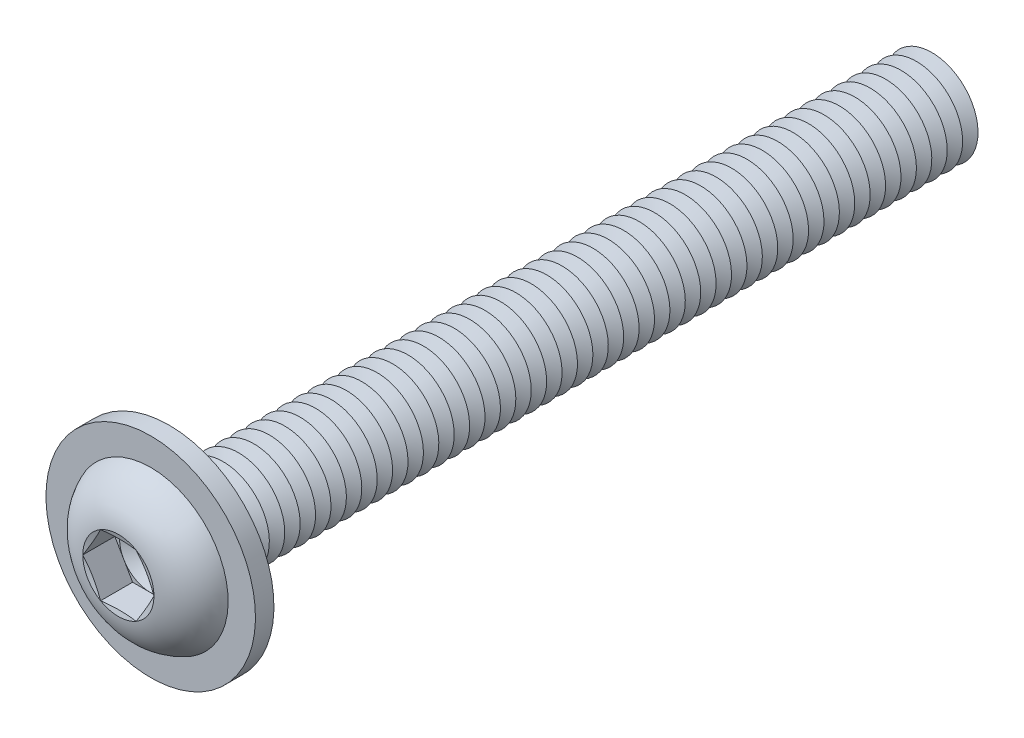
SolidWorks part; units mm, degrees
ref_plane "Front Plane" through (0, 0, 0) normal (0, 0, 1) x (1, 0, 0)
ref_plane "Top Plane" through (0, 0, 0) normal (0, 1, 0) x (1, 0, 0)
ref_plane "Right Plane" through (0, 0, 0) normal (1, 0, 0) x (0, 0, -1)
sketch "Sketch1" plane through (0, 0, 0) normal (1, 0, 0) x (0, 0, -1)
  line L0 (0, 3) -> (0, 5.25)
  line L3 (0, 3) -> (50, 3)
  line L4 (50, 3) -> (50, 0)
  line L5 (50, 0) -> (-3.3, 0) construction
  line L6 (-3.3, 0) -> (50, 0)
  line L7 (-3.3, 2.3094) -> (-3.3, 1.1547) construction
  line L8 (-3.3, 1.1547) -> (-3.3, 0)
  line L9 (-3.3, 2.3094) -> (-2.9906, 1.1547)
  line L10 (-2.9906, 1.1547) -> (-3.3, 1.1547)
  line L11 (50, 0) -> (22.7481, 0) construction
  line L12 (0, 5.25) -> (-3.3, 5.25) construction
  arc A1 (0, 5.25) -> (-3.3, 2.3094) centre (0, 1.928) ccw
  point P8 (50, 1.5)
  dimension "D1" = 10.5
  dimension "D2" = 6
  dimension "D3" = 3.3
  dimension "D4" = 4.6188
  dimension "D5" = 50
  dimension "D6" = 15
revolve "Revolve1" add sketch "Sketch1" angle 360 about L5
fillet "Fillet1" radius 0.5 1 edges at (0, 3, 0)
sketch "Sketch2" plane through (0, 0, 0) normal (1, 0, 0) x (0, 0, -1)
  line L0 (49.5, 3) -> (50.5, 3)
  line L1 (50, 3) -> (0.5, 3) construction
  line L2 (50.5, 3) -> (50, 2.134)
  line L3 (50, -3) -> (50, 3) construction
  line L4 (50, 2.134) -> (49.5, 3)
  dimension "D1" = 1
revolve "Cut-Revolve1" cut sketch "Sketch2" angle 360 about axis through (0, 0, -50) along (0, 0, -1)
pattern_linear "LPattern1" count 50 spacing 1 along (0, 0, 1) of "Cut-Revolve1"
sketch "Sketch3" plane through (0, 0, 3.3) normal (0, 0, 1) x (1, 0, 0)
  line L7 (1.1547, 2) -> (-1.1547, 2)
  line L8 (-1.1547, 2) -> (-2.3094, 0)
  line L9 (-2.3094, 0) -> (-1.1547, -2)
  line L10 (-1.1547, -2) -> (1.1547, -2)
  line L11 (1.1547, -2) -> (2.3094, 0)
  line L12 (2.3094, 0) -> (1.1547, 2)
  circle A0 centre (0, 0) radius 2 construction
  circle A3 centre (0, 0) radius 2.3094 construction
extrude "Cut-Extrude1" cut sketch "Sketch3" against normal blind 2.08
sketch "Sketch4" plane through (0, 0, 1.22) normal (0, 0, 1) x (1, 0, 0)
  line L1 (1.1547, 2) -> (-1.1547, 2) construction
  circle A0 centre (0, 0) radius 2
extrude "Cut-Extrude2" cut sketch "Sketch4" against normal through all draft 60
sketch "Sketch5" plane through (0, 0, 0) normal (0, 0, -1) x (-1, 0, 0)
  circle A0 centre (0, 0) radius 6.8
  circle A1 centre (0, 0) radius 3.5
  circle A2 centre (0, 0) radius 3.5 construction
  dimension "D1" = 13.6
extrude "Boss-Extrude1" add sketch "Sketch5" against normal blind 1.2
